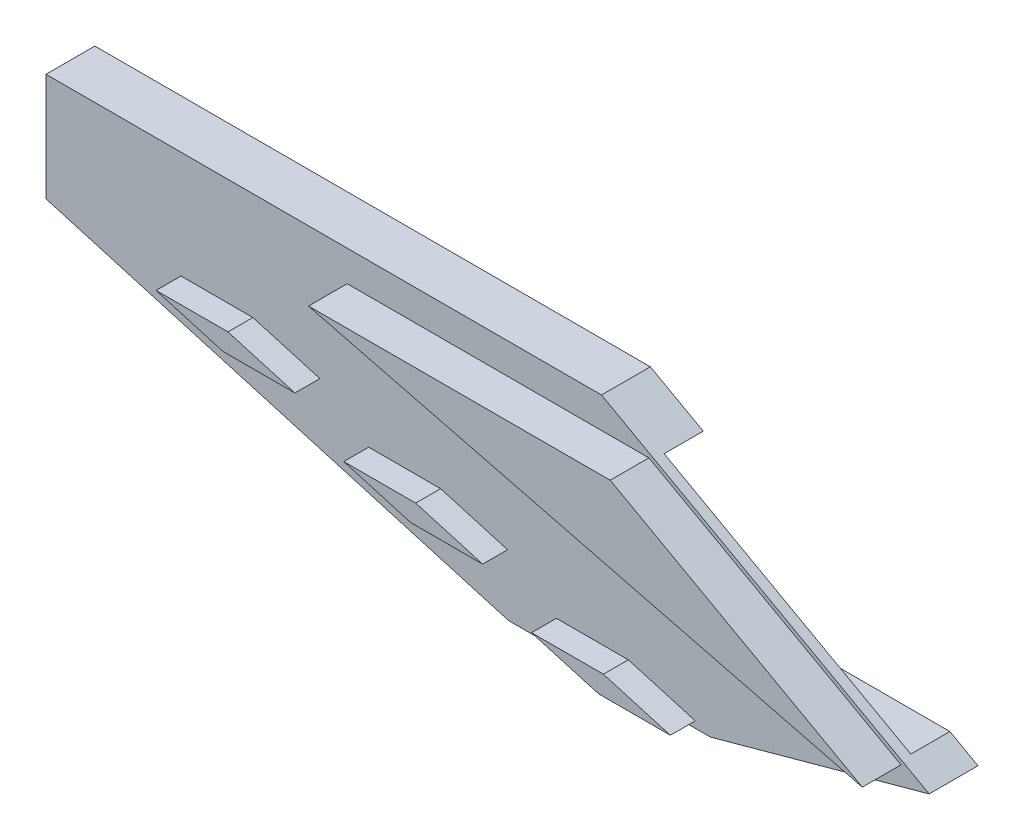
SolidWorks part; units mm, degrees
other "<灯光打印件>-<切除-拉伸9>"
ref_plane "前视基准面" through (0, 0, 0) normal (0, 0, 1) x (1, 0, 0)
ref_plane "上视基准面" through (0, 0, 0) normal (0, 1, 0) x (1, 0, 0)
ref_plane "右视基准面" through (0, 0, 0) normal (1, 0, 0) x (0, 0, -1)
mirrored part "灯光打印件_镜向"
